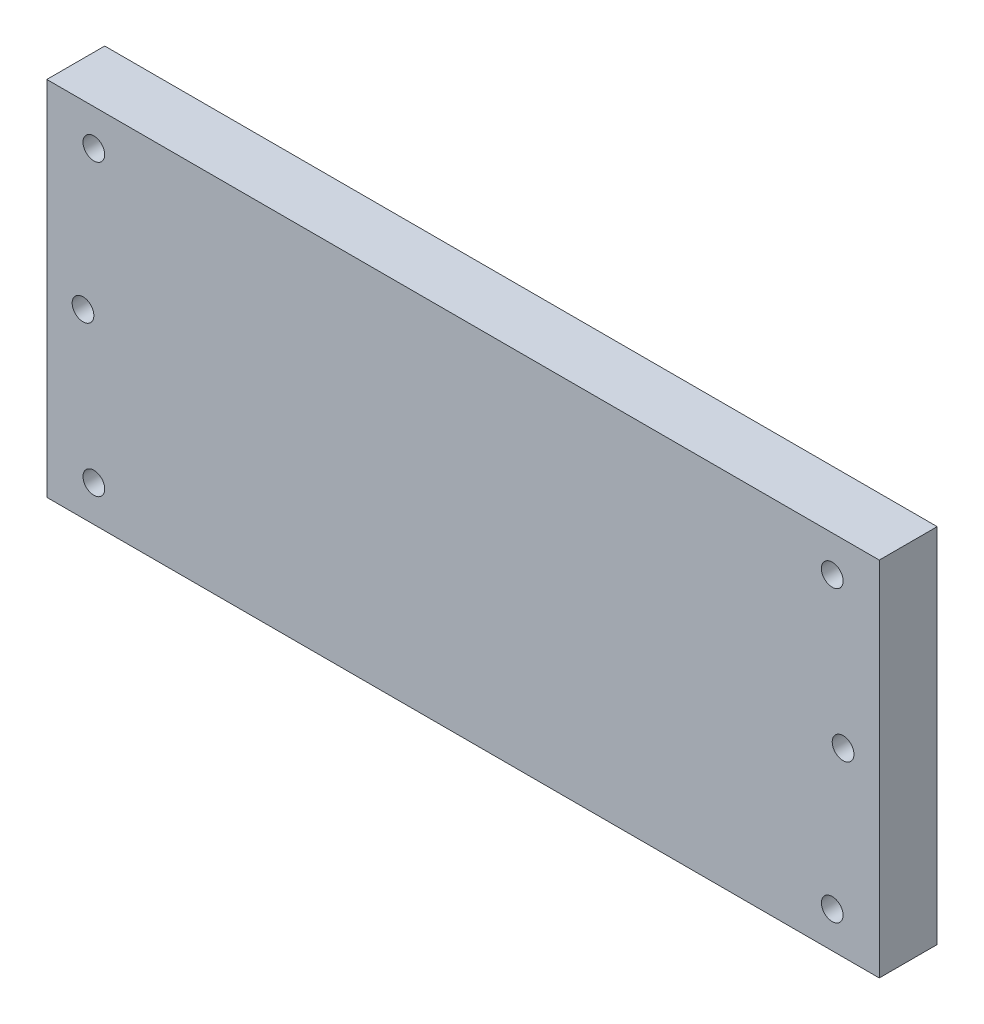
SolidWorks part; units mm, degrees
ref_plane "Plan de face" through (0, 0, 0) normal (0, 0, 1) x (1, 0, 0)
ref_plane "Plan de dessus" through (0, 0, 0) normal (0, 1, 0) x (1, 0, 0)
ref_plane "Plan de droite" through (0, 0, 0) normal (1, 0, 0) x (0, 0, -1)
sketch "Esquisse1" plane through (0, 0, 0) normal (0, 0, 1) x (1, 0, 0)
  line L1 (-33.7316, 28.0933) -> (81.2684, 28.0933)
  line L2 (-33.7316, 28.0933) -> (-33.7316, -21.9067)
  line L3 (-33.7316, -21.9067) -> (81.2684, -21.9067)
  line L4 (81.2684, 28.0933) -> (81.2684, -21.9067)
  dimension "D1" = 115
  dimension "D2" = 50
extrude "Boss.-Extru.1" add sketch "Esquisse1" along normal blind 8
sketch "Esquisse2" plane through (0, 0, 0) normal (0, 0, -1) x (-1, 0, 0)
  line L0 (-81.2684, 28.0933) -> (33.7316, 28.0933) construction
  line L1 (33.7316, -21.9067) -> (-81.2684, -21.9067) construction
  circle A0 centre (-76.2684, 3.0933) radius 4
  circle A1 centre (28.7316, 3.0933) radius 4
  point P2 (-23.7684, 28.0933)
  point P7 (-23.7684, -21.9067)
  dimension "D1" = 52.5
  dimension "D2" = 52.5
extrude "Enlèv. mat.-Extru.1" cut sketch "Esquisse2" against normal blind 4
sketch "Esquisse3" plane through (0, 0, 8) normal (0, 0, 1) x (1, 0, 0)
  line L0 (-33.7316, 28.0933) -> (-33.7316, -21.9067) construction
  line L1 (81.2684, 28.0933) -> (-33.7316, 28.0933) construction
  line L2 (-33.7316, -21.9067) -> (81.2684, -21.9067) construction
  line L3 (81.2684, -21.9067) -> (81.2684, 28.0933) construction
  circle A0 centre (-27.2316, 23.0933) radius 1.5
  circle A1 centre (-27.2316, -16.9067) radius 1.5
  circle A2 centre (74.7684, 23.0933) radius 1.5
  circle A3 centre (74.7684, -16.9067) radius 1.5
  circle A4 centre (-28.7316, 3.0933) radius 1.5
  circle A5 centre (76.2684, 3.0933) radius 1.5
  point P22 (23.7684, 28.0933)
  point P23 (23.7684, -21.9067)
  dimension "D1" = 6.5
  dimension "D9" = 52.5
  dimension "D2" = 5
  dimension "D3" = 6.5
  dimension "D4" = 5
  dimension "D5" = 5
  dimension "D6" = 6.5
  dimension "D7" = 6.5
  dimension "D8" = 5
  dimension "D10" = 52.5
extrude "Enlèv. mat.-Extru.2" cut sketch "Esquisse3" against normal blind 10
